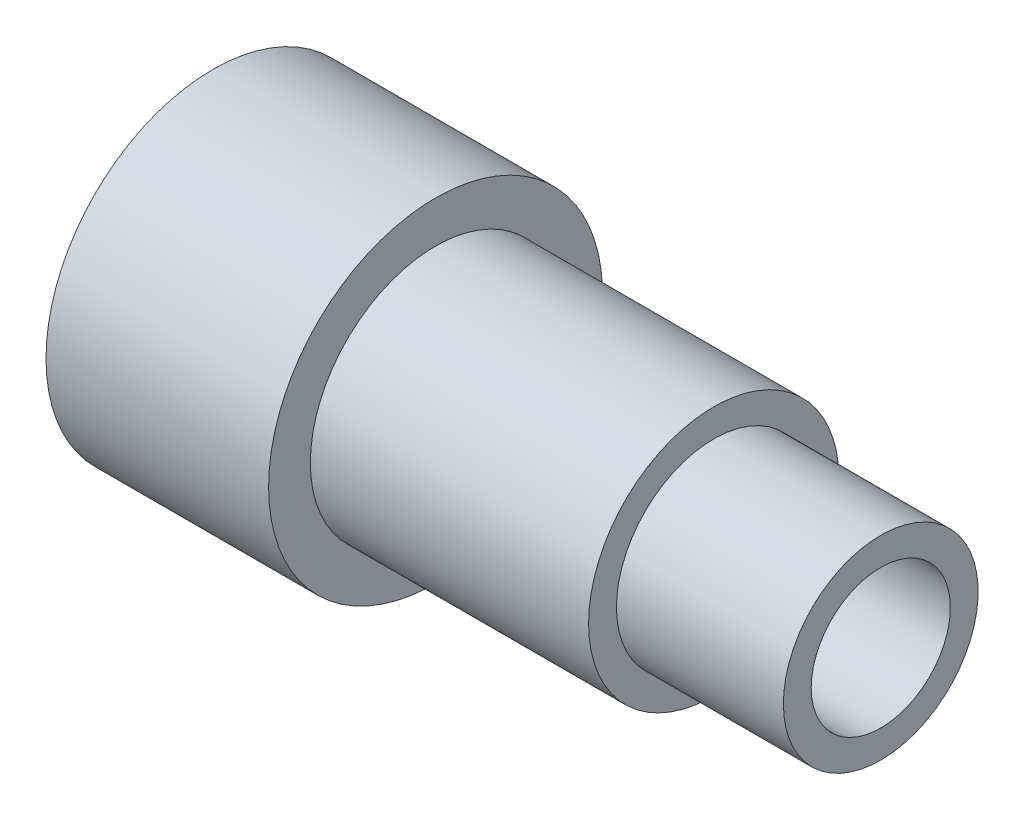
SolidWorks part; units mm, degrees
ref_plane "前视基准面" through (0, 0, 0) normal (0, 0, 1) x (1, 0, 0)
ref_plane "上视基准面" through (0, 0, 0) normal (0, 1, 0) x (1, 0, 0)
ref_plane "右视基准面" through (0, 0, 0) normal (1, 0, 0) x (0, 0, -1)
other "Configuration Table"
sketch "草图1" plane through (0, 0, 0) normal (0, 0, 1) x (1, 0, 0)
  line L0 (0, 0) -> (120, 0) construction
  line L1 (0, 12.5) -> (0, 30)
  line L2 (0, 30) -> (40, 30)
  line L3 (40, 30) -> (40, 22.5)
  line L4 (40, 22.5) -> (90, 22.5)
  line L5 (90, 22.5) -> (90, 17.5)
  line L6 (90, 17.5) -> (120, 17.5)
  line L7 (120, 17.5) -> (120, 12.5)
  line L8 (120, 12.5) -> (0, 12.5)
revolve "旋转1" add sketch "草图1" angle 360 about L0
sketch "草图2" plane through (0, 0, 0) normal (0, 1, 0) x (1, 0, 0)
  circle A0 centre (65, 0) radius 3
extrude "切除-拉伸1" cut sketch "草图2" against normal blind 30
sketch "草图3" plane through (0, 0, 0) normal (0, 0, 1) x (1, 0, 0)
  line L1 (-4, 9) -> (4, 9)
  line L2 (-4, 9) -> (-4, 17)
  line L3 (-4, 17) -> (4, 17)
  line L4 (4, 9) -> (4, 17)
  line L5 (-4, 9) -> (4, 17) construction
  line L6 (-4, 17) -> (4, 9) construction
  point P0 (0, 13)
extrude "切除-拉伸2" cut sketch "草图3" against normal blind 130
